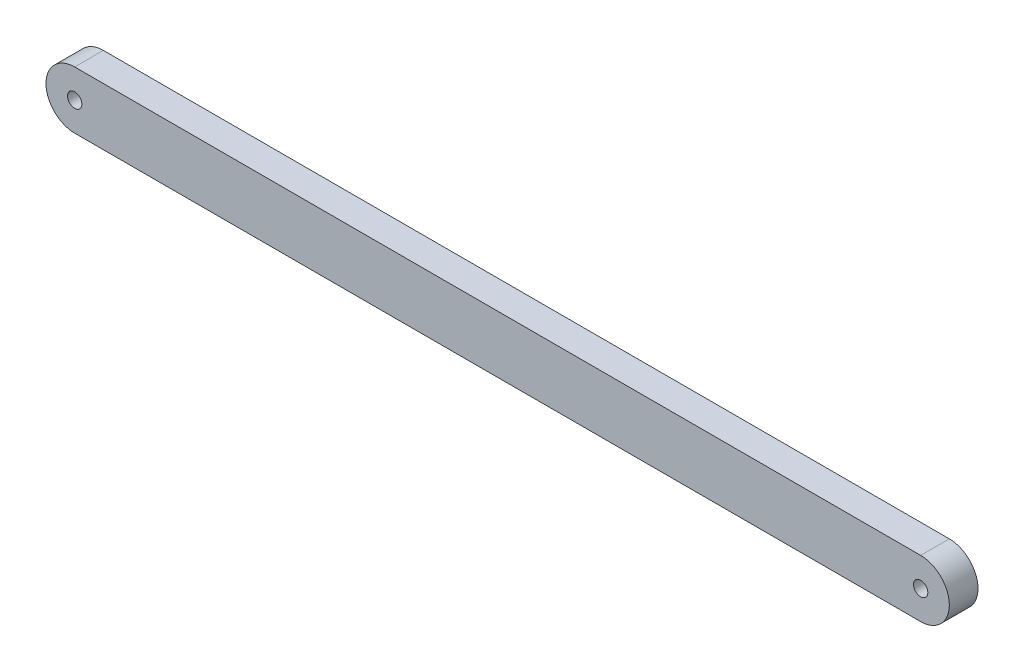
SolidWorks part; units mm, degrees
ref_plane "Front Plane" through (0, 0, 0) normal (0, 0, 1) x (1, 0, 0)
ref_plane "Top Plane" through (0, 0, 0) normal (0, 1, 0) x (1, 0, 0)
ref_plane "Right Plane" through (0, 0, 0) normal (1, 0, 0) x (0, 0, -1)
sketch "Sketch1" plane through (0, 0, 0) normal (0, 0, 1) x (1, 0, 0)
  line L0 (0, 0) -> (74.93, 0) construction
  line L1 (0, 2.54) -> (74.93, 2.54)
  line L2 (0, -2.54) -> (74.93, -2.54)
  arc A0 (0, 2.54) -> (0, -2.54) centre (0, 0) ccw
  arc A1 (74.93, -2.54) -> (74.93, 2.54) centre (74.93, 0) ccw
  point P3 (37.465, 0)
  dimension "D1" = 2.54
  dimension "D2" = 74.93
extrude "Boss-Extrude1" add sketch "Sketch1" along normal blind 2.54
sketch "Sketch2" plane through (0, 0, 2.54) normal (0, 0, 1) x (1, 0, 0)
  circle A0 centre (0, 0) radius 0.635
  dimension "D1" = 1.27
extrude "Cut-Extrude1" cut sketch "Sketch2" against normal through all both and the other way through all
ref_plane "Plane1" through (37.465, 0, 0) normal (1, 0, 0) x (0, 0, -1)
mirror "Mirror1" about plane through (37.465, 0, 0) normal (1, 0, 0) of "Cut-Extrude1"
